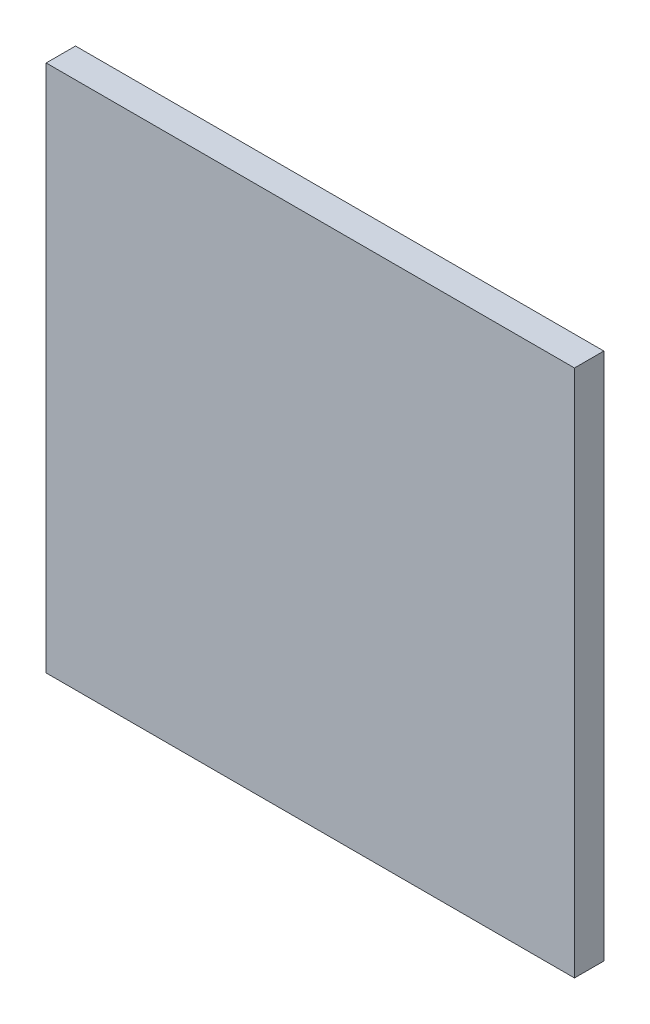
SolidWorks part; units mm, degrees
ref_plane "Front Plane" through (0, 0, 0) normal (0, 0, 1) x (1, 0, 0)
ref_plane "Top Plane" through (0, 0, 0) normal (0, 1, 0) x (1, 0, 0)
ref_plane "Right Plane" through (0, 0, 0) normal (1, 0, 0) x (0, 0, -1)
sketch "Sketch1" plane through (0, 0, 0) normal (0, 0, 1) x (1, 0, 0)
  line L1 (-57.15, 57.15) -> (57.15, 57.15)
  line L2 (-57.15, 57.15) -> (-57.15, -57.15)
  line L3 (-57.15, -57.15) -> (57.15, -57.15)
  line L4 (57.15, 57.15) -> (57.15, -57.15)
  line L5 (-57.15, 57.15) -> (57.15, -57.15) construction
  line L6 (-57.15, -57.15) -> (57.15, 57.15) construction
  point P0 (0, 0)
  dimension "D1" = 114.3
  dimension "D2" = 114.3
extrude "Boss-Extrude1" add sketch "Sketch1" along normal blind 6.35
